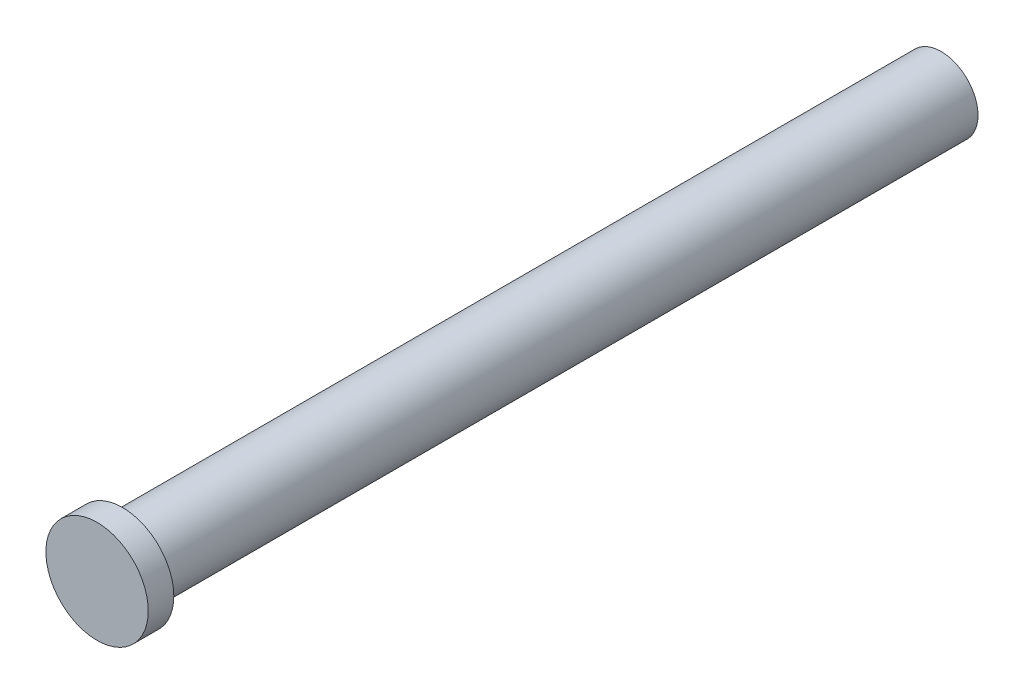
SolidWorks part; units mm, degrees
ref_plane "Front Plane" through (0, 0, 0) normal (0, 0, 1) x (1, 0, 0)
ref_plane "Top Plane" through (0, 0, 0) normal (0, 1, 0) x (1, 0, 0)
ref_plane "Right Plane" through (0, 0, 0) normal (1, 0, 0) x (0, 0, -1)
sketch "Sketch1" plane through (0, 0, 0) normal (0, 0, 1) x (1, 0, 0)
  circle A0 centre (0, 0) radius 4.572
  dimension "D1" = 9.144
extrude "Boss-Extrude1" add sketch "Sketch1" along normal blind 101.6
sketch "Sketch2" plane through (0, 0, 101.6) normal (0, 0, 1) x (1, 0, 0)
  circle A0 centre (0, 0) radius 6.35
  dimension "D1" = 12.7
extrude "Boss-Extrude2" add sketch "Sketch2" along normal blind 3.175
